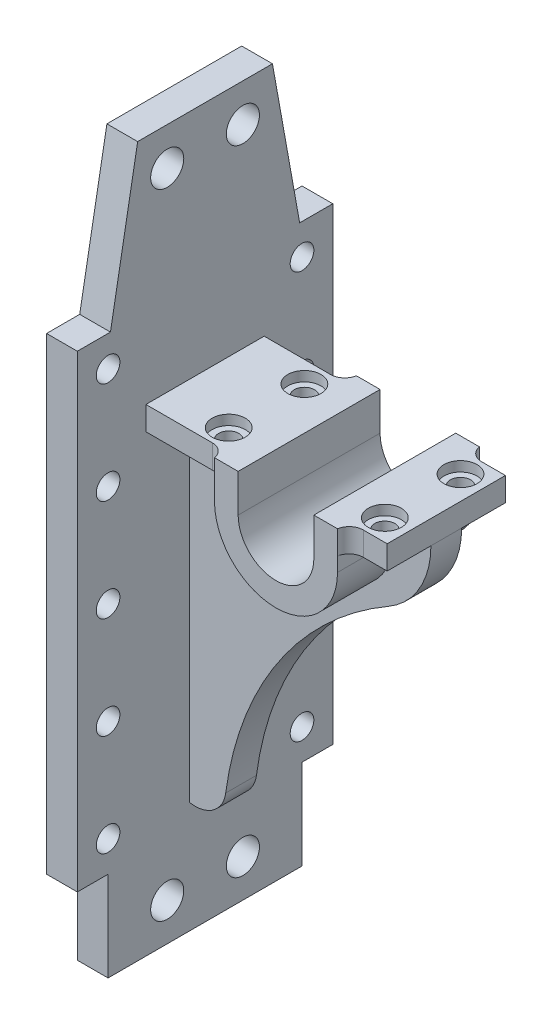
SolidWorks part; units mm, degrees
ref_plane "Front Plane" through (0, 0, 0) normal (0, 0, 1) x (1, 0, 0)
ref_plane "Top Plane" through (0, 0, 0) normal (0, 1, 0) x (1, 0, 0)
ref_plane "Right Plane" through (0, 0, 0) normal (1, 0, 0) x (0, 0, -1)
sketch "Sketch1" plane through (0, 0, 0) normal (1, 0, 0) x (0, 0, -1)
  line L0 (0, 65.3402) -> (0, -65.3402) construction
  line L1 (-58.8201, 0) -> (58.8201, 0) construction
  line L2 (-40, 99) -> (-28.5, 163)
  line L3 (-54, 99) -> (-40, 99)
  line L4 (-54, 99) -> (-54, -99)
  line L5 (-54, -99) -> (-41, -99)
  line L6 (54, 99) -> (54, -99)
  line L7 (-28.5, 163) -> (28.5, 163)
  line L8 (28.5, 163) -> (40, 99)
  line L9 (-41, -99) -> (-41, -137)
  line L10 (-41, -137) -> (41, -137)
  line L11 (41, -137) -> (41, -99)
  line L12 (40, 99) -> (54, 99)
  line L13 (41, -99) -> (54, -99)
  dimension "D1" = 108
  dimension "D2" = 198
  dimension "D3" = 64
  dimension "D4" = 38
  dimension "D5" = 57
  dimension "D6" = 82
  dimension "D7" = 80
extrude "Boss-Extrude1" add sketch "Sketch1" along normal blind 13
sketch "Sketch2" plane through (0, 0, 0) normal (0, 0, 1) x (1, 0, 0)
  line L0 (13, 65) -> (57, 65)
  line L1 (13, 99) -> (13, -99) construction
  line L2 (13, 163) -> (0, 163) construction
  line L3 (115, 65) -> (115, 55)
  line L4 (115, 55) -> (99, 55)
  line L5 (13, 55) -> (13, 65)
  line L6 (47, 49) -> (47, 55)
  line L7 (99, 49) -> (99, 55)
  line L8 (57, 49) -> (57, 65)
  line L9 (89, 49) -> (89, 65)
  line L10 (47, 55) -> (13, 55)
  line L11 (89, 65) -> (115, 65)
  arc A0 (57, 49) -> (89, 49) centre (73, 49) ccw
  arc A1 (47, 49) -> (99, 49) centre (73, 49) ccw
  dimension "D4" = 16
  dimension "D6" = 10
  dimension "D1" = 98
  dimension "D2" = 102
  dimension "D3" = 10
  dimension "D5" = 16
  dimension "D7" = 42
extrude "Boss-Extrude2" add sketch "Sketch2" along normal mid plane 60
sketch "Sketch3" plane through (0, 65, 0) normal (0, 1, 0) x (1, 0, 0)
  line L0 (13, 30) -> (13, 25)
  line L1 (13, 28.5) -> (13, -28.5) construction
  line L2 (13, 25) -> (41.0839, 25)
  line L3 (47, 30) -> (13, 30)
  line L4 (0, 0) -> (113.5167, 0) construction
  line L5 (115, 30) -> (115, 25)
  line L6 (115, -30) -> (115, 30) construction
  line L7 (115, 25) -> (104.9161, 25)
  line L8 (115, 30) -> (89, 30) construction
  line L9 (99, 30) -> (115, 30)
  arc A0 (41.0839, 25) -> (47, 30) centre (41.0839, 31) ccw
  arc A1 (104.9161, 25) -> (99, 30) centre (104.9161, 31) cw
  dimension "D1" = 6
  dimension "D3" = 6
  dimension "D2" = 25
  dimension "D4" = 25
extrude "Cut-Extrude1" cut sketch "Sketch3" against normal through all
mirror "Mirror1" about plane through (0, 0, 0) normal (0, 0, 1) of "Cut-Extrude1"
sketch "Sketch4" plane through (0, 0, 0) normal (0, 0, 1) x (1, 0, 0)
  line L1 (115, 55) -> (115, 65) construction
  line L2 (13, 99) -> (13, -99) construction
  line L3 (13, 55) -> (41.0839, 55) construction
  arc A0 (115, 55) -> (97, 23.8231) centre (79, 55) cw
  arc A1 (97, 23.8231) -> (28.2265, -78.9294) centre (167, -97.4205) ccw
  arc A2 (28.2265, -78.9294) -> (13, -90) centre (15.3404, -77.2124) cw
  dimension "D2" = 36
  dimension "D3" = 140
  dimension "D4" = 60
  dimension "D1" = 13
  dimension "D5" = 145
rib "Rib1" sketch "Sketch4" sketch "Sketch4" thickness 13 extrusion direction parallel to sketch draft on no parameters "D1"=13
other "Hole1"
sketch "Sketch11" plane through (13, 0, 0) normal (1, 0, 0) x (0, 0, -1)
  line L0 (-54, 99) -> (-54, -99) construction
  line L1 (-40, 99) -> (-54, 99) construction
  circle A0 centre (-41, 86) radius 5
  dimension "D1" = 10
  dimension "D2" = 13
  dimension "D3" = 13
other "Hole2" parameters "D1"=20
sketch "Sketch12" plane through (13, 0, 0) normal (1, 0, 0) x (0, 0, -1)
  line L0 (28.5, 163) -> (-28.5, 163) construction
  circle A0 centre (-16, 147) radius 7
  dimension "D1" = 14
  dimension "D2" = 16
  dimension "D3" = 16
pattern_linear "LPattern6" count 5 spacing 43 along (0, -1, 0) count 2 spacing 82 along (0, 0, -1) of "Hole1"
pattern_linear "LPattern7" count 2 spacing 32 along (0, 0, -1) count 2 spacing 268 along (0, -1, 0) of "Hole2"
hole_wizard "CBORE for M8 SBHCS3" positions "Sketch25" profile "Sketch24" counterbore size "M8" standard "ANSI Metric"
sketch "Sketch25" plane through (0, 65, 0) normal (0, 1, 0) x (1, 0, 0)
  line L0 (115, -25) -> (115, 25) construction
  line L1 (104.9161, -25) -> (115, -25) construction
  point P0 (105, -16)
  dimension "D1" = 10
  dimension "D2" = 9
sketch "Sketch24" plane through (105, 65, 16) normal (1, 0, 0) x (0, 0, 1)
  line L0 (0, 0) -> (0, 202)
  line L1 (0, 202) -> (4.25, 202)
  line L3 (4.25, 202) -> (4.25, 4.2)
  line L4 (4.25, 4.2) -> (7, 4.2)
  line L5 (7, 4.2) -> (7, 0)
  line L7 (7, 0) -> (0, 0)
  line L11 (0, -6.35) -> (0, 107.95) construction
  dimension "Thru Hole Dia." = 8.5
  dimension "Thru Hole Depth" = 202
  dimension "C'Bore Dia." = 14
  dimension "C'Bore Depth" = 4.2
pattern_linear "LPattern8" count 2 spacing 66 along (-1, 0, 0) count 2 spacing 32 along (0, 0, -1) of "CBORE for M8 SBHCS3"
